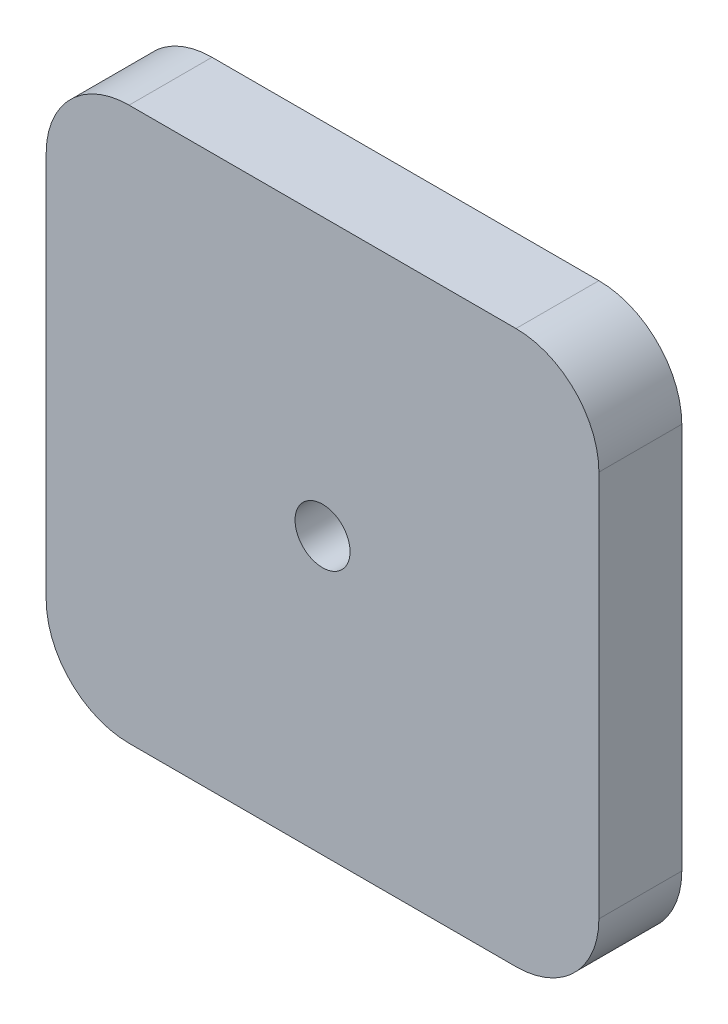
SolidWorks part; units mm, degrees
ref_plane "Front Plane" through (0, 0, 0) normal (0, 0, 1) x (1, 0, 0)
ref_plane "Top Plane" through (0, 0, 0) normal (0, 1, 0) x (1, 0, 0)
ref_plane "Right Plane" through (0, 0, 0) normal (1, 0, 0) x (0, 0, -1)
sketch "Sketch1" plane through (0, 0, 0) normal (0, 0, 1) x (1, 0, 0)
  line L1 (-234.3421, 35.8844) -> (-220.3421, 35.8844)
  line L2 (-237.3421, 38.8844) -> (-237.3421, 52.8844)
  line L3 (-234.3421, 55.8844) -> (-220.3421, 55.8844)
  line L4 (-217.3421, 38.8844) -> (-217.3421, 52.8844)
  line L5 (-237.3421, 35.8844) -> (-217.3421, 55.8844) construction
  line L6 (-237.3421, 55.8844) -> (-217.3421, 35.8844) construction
  circle A0 centre (-227.3421, 45.8844) radius 0.9954
  arc A1 (-237.3421, 38.8844) -> (-234.3421, 35.8844) centre (-234.3421, 38.8844) ccw
  arc A2 (-220.3421, 35.8844) -> (-217.3421, 38.8844) centre (-220.3421, 38.8844) ccw
  arc A3 (-217.3421, 52.8844) -> (-220.3421, 55.8844) centre (-220.3421, 52.8844) ccw
  arc A4 (-234.3421, 55.8844) -> (-237.3421, 52.8844) centre (-234.3421, 52.8844) ccw
  point P0 (-227.3421, 45.8844)
  dimension "D1" = 3
extrude "Boss-Extrude1" add sketch "Sketch1" along normal blind 3
